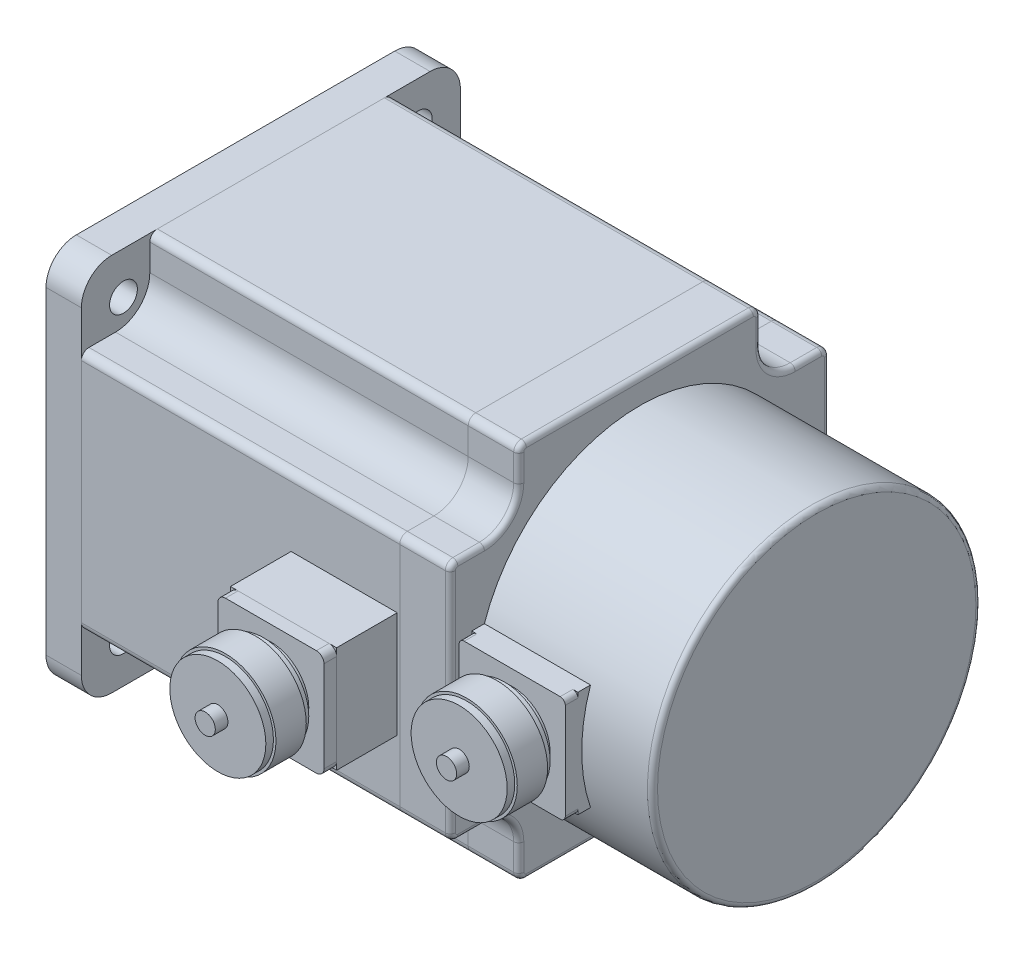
SolidWorks part; units mm, degrees
ref_plane "前视基准面" through (0, 0, 0) normal (0, 0, 1) x (1, 0, 0)
ref_plane "上视基准面" through (0, 0, 0) normal (0, 1, 0) x (1, 0, 0)
ref_plane "右视基准面" through (0, 0, 0) normal (1, 0, 0) x (0, 0, -1)
sketch "草图1" plane through (0, 0, 0) normal (1, 0, 0) x (0, 0, -1)
  line L1 (-63, -75) -> (63, -75)
  line L2 (-75, -63) -> (-75, 63)
  line L3 (-63, 75) -> (63, 75)
  line L4 (75, -63) -> (75, 63)
  line L5 (-75, -75) -> (75, 75) construction
  line L6 (-75, 75) -> (75, -75) construction
  arc A0 (63, -75) -> (75, -63) centre (63, -63) ccw
  arc A1 (-63, -75) -> (-75, -63) centre (-63, -63) cw
  arc A2 (-75, 63) -> (-63, 75) centre (-63, 63) cw
  arc A3 (63, 75) -> (75, 63) centre (63, 63) cw
  point P0 (0, 0)
  dimension "D1" = 12
extrude "凸台-拉伸1" add sketch "草图1" along normal blind 20
sketch "草图2" plane through (0, 0, 0) normal (-1, 0, 0) x (0, 0, 1)
  line L0 (-63, 75) -> (63, 75) construction
  line L1 (-63, -75) -> (63, -75)
  line L2 (-75, -63) -> (-75, 63)
  line L3 (-63, 75) -> (63, 75)
  line L4 (75, -63) -> (75, 63)
  line L5 (-75, -75) -> (75, 75) construction
  line L6 (-75, 75) -> (75, -75) construction
  arc A0 (63, 75) -> (75, 63) centre (63, 63) cw
  arc A1 (63, -75) -> (75, -63) centre (63, -63) ccw
  arc A2 (-63, -75) -> (-75, -63) centre (-63, -63) cw
  arc A3 (-75, 63) -> (-63, 75) centre (-63, 63) cw
  point P0 (0, 0)
  dimension "D1" = 12
extrude "凸台-拉伸2" add sketch "草图2" along normal blind 126 separate body
sketch "草图3" plane through (-126, 0, 0) normal (-1, 0, 0) x (0, 0, 1)
  line L0 (63, 75) -> (-63, 75) construction
  line L1 (-63, -75) -> (63, -75)
  line L2 (-75, -63) -> (-75, 63)
  line L3 (-63, 75) -> (63, 75)
  line L4 (75, -63) -> (75, 63)
  line L5 (-75, -75) -> (75, 75) construction
  line L6 (-75, 75) -> (75, -75) construction
  arc A0 (-63, -75) -> (-75, -63) centre (-63, -63) cw
  arc A1 (63, -75) -> (75, -63) centre (63, -63) ccw
  arc A2 (63, 75) -> (75, 63) centre (63, 63) cw
  arc A3 (-75, 63) -> (-63, 75) centre (-63, 63) cw
  point P0 (0, 0)
  dimension "D1" = 12
extrude "凸台-拉伸3" add sketch "草图3" along normal blind 14 separate body
sketch "草图4" plane through (0, 0, 75) normal (0, 0, 1) x (1, 0, 0)
  line L2 (-43, -21) -> (-1, -21)
  line L3 (-43, -21) -> (-43, 21)
  line L4 (-43, 21) -> (-1, 21)
  line L5 (-1, -21) -> (-1, 21)
  line L6 (-43, -21) -> (-1, 21) construction
  line L7 (-43, 21) -> (-1, -21) construction
extrude "凸台-拉伸4" add sketch "草图4" along normal blind 24 separate body
sketch "草图5" plane through (0, 0, 99) normal (0, 0, 1) x (1, 0, 0)
  line L0 (-1, 21) -> (-43, 21) construction
  line L1 (-40, -21) -> (-4, -21)
  line L2 (-43, -18) -> (-43, 18)
  line L3 (-40, 21) -> (-4, 21)
  line L4 (-1, -18) -> (-1, 18)
  line L5 (-43, -21) -> (-1, 21) construction
  line L6 (-43, 21) -> (-1, -21) construction
  arc A0 (-40, -21) -> (-43, -18) centre (-40, -18) cw
  arc A1 (-4, -21) -> (-1, -18) centre (-4, -18) ccw
  arc A2 (-4, 21) -> (-1, 18) centre (-4, 18) cw
  arc A3 (-43, 18) -> (-40, 21) centre (-40, 18) cw
  point P0 (-22, 0)
  dimension "D1" = 3
extrude "凸台-拉伸5" add sketch "草图5" along normal blind 5 separate body
sketch "草图6" plane through (0, 0, 104) normal (0, 0, 1) x (1, 0, 0)
  circle A0 centre (-22, 0) radius 15
extrude "凸台-拉伸6" add sketch "草图6" along normal blind 3 separate body
sketch "草图7" plane through (0, 0, 107) normal (0, 0, 1) x (1, 0, 0)
  circle A0 centre (-22, 0) radius 18
extrude "凸台-拉伸7" add sketch "草图7" along normal blind 3 separate body
sketch "草图8" plane through (0, 0, 110) normal (0, 0, 1) x (1, 0, 0)
  circle A0 centre (-22, 0) radius 20
extrude "凸台-拉伸8" add sketch "草图8" along normal blind 12 separate body
sketch "草图9" plane through (0, 0, 122) normal (0, 0, 1) x (1, 0, 0)
  circle A0 centre (-22, 0) radius 19
extrude "凸台-拉伸9" add sketch "草图9" along normal blind 3
sketch "草图10" plane through (0, 0, 125) normal (0, 0, 1) x (1, 0, 0)
  circle A0 centre (-22, 0) radius 4
extrude "凸台-拉伸10" add sketch "草图10" along normal blind 5
sketch "草图11" plane through (20, 0, 0) normal (1, 0, 0) x (0, 0, -1)
  line L0 (47.9169, -61.5) -> (47.9169, -72)
  line L1 (-75, -44.9169) -> (-75, -63)
  line L2 (-63, -75) -> (-44.9169, -75)
  line L3 (44.9169, -75) -> (63, -75)
  line L4 (75, -63) -> (75, -44.9169)
  line L6 (75, 63) -> (75, 44.9169)
  line L7 (-63, -75) -> (63, -75) construction
  line L8 (63, 75) -> (44.9169, 75)
  line L9 (-47.9169, -72) -> (-47.9169, -61.5)
  line L10 (-44.9169, 75) -> (-63, 75)
  line L11 (-61.5, -47.9169) -> (-72, -47.9169)
  line L12 (75, -63) -> (75, 63) construction
  line L13 (-75, 63) -> (-75, 44.9169)
  line L14 (-72, 47.9169) -> (-61.5, 47.9169)
  line L16 (-47.9169, 61.5) -> (-47.9169, 72)
  line L17 (63, 75) -> (-63, 75) construction
  line L19 (47.9169, 72) -> (47.9169, 61.5)
  line L21 (61.5, 47.9169) -> (72, 47.9169)
  line L22 (-75, 63) -> (-75, -63) construction
  line L24 (72, -47.9169) -> (61.5, -47.9169)
  arc A0 (-61.5, 47.9169) -> (-47.9169, 61.5) centre (-61.5, 61.5) ccw
  arc A1 (47.9169, 61.5) -> (61.5, 47.9169) centre (61.5, 61.5) ccw
  arc A2 (-47.9169, -61.5) -> (-61.5, -47.9169) centre (-61.5, -61.5) ccw
  arc A3 (-72, -47.9169) -> (-75, -44.9169) centre (-72, -44.9169) cw
  arc A4 (61.5, -47.9169) -> (47.9169, -61.5) centre (61.5, -61.5) ccw
  arc A5 (-75, 44.9169) -> (-72, 47.9169) centre (-72, 44.9169) cw
  arc A6 (-47.9169, 72) -> (-44.9169, 75) centre (-44.9169, 72) cw
  arc A7 (44.9169, 75) -> (47.9169, 72) centre (44.9169, 72) cw
  arc A8 (72, 47.9169) -> (75, 44.9169) centre (72, 44.9169) cw
  arc A9 (75, -44.9169) -> (72, -47.9169) centre (72, -44.9169) cw
  arc A10 (47.9169, -72) -> (44.9169, -75) centre (44.9169, -72) cw
  arc A11 (-44.9169, -75) -> (-47.9169, -72) centre (-44.9169, -72) cw
  arc A12 (-63, 75) -> (-75, 63) centre (-63, 63) ccw
  arc A13 (75, 63) -> (63, 75) centre (63, 63) ccw
  arc A14 (63, -75) -> (75, -63) centre (63, -63) ccw
  arc A15 (-75, -63) -> (-63, -75) centre (-63, -63) ccw
  point P0 (0, 0)
  point P1 (0, 0)
  point P12 (-75, -47.9169)
  point P43 (-75, 47.9169)
  point P47 (-47.9169, 75)
  point P48 (51.9891, -75)
  point P52 (47.9169, 75)
  point P56 (75, 47.9169)
  point P65 (75, -47.9169)
  point P82 (-47.9169, -75)
  dimension "D1" = 3
extrude "切除-拉伸2" cut sketch "草图11" against normal blind 146
fillet "圆角1" radius 2 24 edges at (20, 75, 0) (20, 0, -75) (20, -75, 0) (20, 0, 75) (20, 47.0382, 74.1213) (20, 47.9169, 66.75) (20, 51.8953, 51.8953) (20, 66.75, 47.9169) (20, 74.1213, 47.0382) (20, 74.1213, -47.0382) (20, 66.75, -47.9169) (20, 51.8953, -51.8953) (20, 47.9169, -66.75) (20, 47.0382, -74.1213) (20, -47.0382, -74.1213) (20, -47.9169, -66.75) (20, -51.8953, -51.8953) (20, -66.75, -47.9169) (20, -74.1213, -47.0382) (20, -74.1213, 47.0382) (20, -66.75, 47.9169) (20, -51.8953, 51.8953) (20, -47.9169, 66.75) (20, -47.0382, 74.1213)
sketch "草图12" plane through (-140, 0, 0) normal (-1, 0, 0) x (0, 0, 1)
  circle A2 centre (-58.3363, 58.3363) radius 5.5
  circle A3 centre (58.3363, 58.3363) radius 5.5
  circle A4 centre (58.3363, -58.3363) radius 5.5
  circle A5 centre (-58.3363, -58.3363) radius 5.5
extrude "切除-拉伸3" cut sketch "草图12" against normal blind 14
sketch "草图13" plane through (-140, 0, 0) normal (-1, 0, 0) x (0, 0, 1)
  circle A0 centre (0, 0) radius 65
  circle A1 centre (0, 0) radius 57.5
extrude "凸台-拉伸11" add sketch "草图13" along normal blind 5 separate body
sketch "草图14" plane through (-140, 0, 0) normal (-1, 0, 0) x (0, 0, 1)
  circle A0 centre (0, 0) radius 35
extrude "凸台-拉伸12" add sketch "草图14" along normal blind 5
sketch "草图15" plane through (-145, 0, 0) normal (-1, 0, 0) x (0, 0, 1)
  circle A0 centre (0, 0) radius 17.5
extrude "凸台-拉伸13" add sketch "草图15" along normal blind 0.5 separate body
fillet "圆角2" radius 0.5 1 edges at (-145.5, 0, 17.5)
sketch "草图16" plane through (-145.5, 0, 0) normal (-1, 0, 0) x (0, 0, 1)
  circle A0 centre (0, 0) radius 14
extrude "凸台-拉伸14" add sketch "草图16" along normal blind 52.5
chamfer "倒角1" distance 0.5 angle 45 1 edges at (-198, 0, 14)
ref_plane "基准面1" through (0, -14, 0) normal (0, 1, 0) x (1, 0, 0)
sketch "草图19" plane through (20, 0, 0) normal (1, 0, 0) x (0, 0, -1)
  circle A0 centre (0, 0) radius 65
extrude "凸台-拉伸16" add sketch "草图19" along normal blind 70 separate body
fillet "圆角3" radius 2 1 edges at (90, 0, -65)
ref_plane "基准面2" through (0, 0, 65) normal (0, 0, 1) x (1, 0, 0)
sketch "草图20" plane through (0, 0, 65) normal (0, 0, 1) x (1, 0, 0)
  line L1 (20, 65) -> (20, -65) construction
  line L3 (62, -21) -> (20, -21)
  line L4 (62, -21) -> (62, 21)
  line L5 (62, 21) -> (20, 21)
  line L6 (20, -21) -> (20, 21)
  line L7 (62, -21) -> (20, 21) construction
  line L8 (62, 21) -> (20, -21) construction
extrude "切除-拉伸5" cut sketch "草图20" against normal blind 10
sketch "草图21" plane through (0, 0, 55) normal (0, 0, 1) x (1, 0, 0)
  line L0 (62, 21) -> (20, 21) construction
  line L1 (20, -21) -> (62, -21)
  line L2 (20, -21) -> (20, 21)
  line L3 (20, 21) -> (62, 21)
  line L4 (62, -21) -> (62, 21)
  line L5 (20, -21) -> (62, 21) construction
  line L6 (20, 21) -> (62, -21) construction
  line L7 (20, 21) -> (62, 21) construction
  point P0 (41, 0)
extrude "凸台-拉伸17" add sketch "草图21" along normal blind 11.5
sketch "草图22" plane through (0, 0, 66.5) normal (0, 0, 1) x (1, 0, 0)
  line L0 (62, -21) -> (62, 21) construction
  line L1 (22, -21) -> (60, -21)
  line L2 (20, -19) -> (20, 19)
  line L3 (22, 21) -> (60, 21)
  line L4 (62, -19) -> (62, 19)
  line L5 (20, -21) -> (62, 21) construction
  line L6 (20, 21) -> (62, -21) construction
  line L7 (20, 21) -> (62, 21) construction
  arc A0 (22, -21) -> (20, -19) centre (22, -19) cw
  arc A1 (60, -21) -> (62, -19) centre (60, -19) ccw
  arc A2 (60, 21) -> (62, 19) centre (60, 19) cw
  arc A3 (20, 19) -> (22, 21) centre (22, 19) cw
  point P0 (41, 0)
  dimension "D1" = 2
extrude "凸台-拉伸18" add sketch "草图22" along normal blind 5 separate body
sketch "草图23" plane through (0, 0, 71.5) normal (0, 0, 1) x (1, 0, 0)
  circle A0 centre (41, 0) radius 15
extrude "凸台-拉伸19" add sketch "草图23" along normal blind 3
sketch "草图24" plane through (0, 0, 74.5) normal (0, 0, 1) x (1, 0, 0)
  circle A0 centre (41, 0) radius 18
extrude "凸台-拉伸20" add sketch "草图24" along normal blind 3
sketch "草图25" plane through (0, 0, 77.5) normal (0, 0, 1) x (1, 0, 0)
  circle A0 centre (41, 0) radius 20
extrude "凸台-拉伸21" add sketch "草图25" along normal blind 12
sketch "草图26" plane through (0, 0, 89.5) normal (0, 0, 1) x (1, 0, 0)
  circle A0 centre (41, 0) radius 19
extrude "凸台-拉伸22" add sketch "草图26" along normal blind 3
sketch "草图27" plane through (0, 0, 92.5) normal (0, 0, 1) x (1, 0, 0)
  circle A0 centre (41, 0) radius 4
extrude "凸台-拉伸23" add sketch "草图27" along normal blind 5
sketch "草图36" plane through (0, -14, 0) normal (0, 1, 0) x (1, 0, 0)
  line L3 (-190, -4) -> (-153, -4)
  line L5 (-153, 4) -> (-190, 4)
  arc A0 (-190, 4) -> (-190, -4) centre (-190, 0) ccw
  arc A1 (-153, -4) -> (-153, 4) centre (-153, 0) ccw
extrude "切除-拉伸9" cut sketch "草图36" along normal blind 5
sketch "草图37" plane through (0, -9, 0) normal (0, -1, 0) x (1, 0, 0)
  line L0 (-190, 4) -> (-153, 4)
  line L2 (-153, -4) -> (-190, -4)
  arc A0 (-190, 4) -> (-190, -4) centre (-190, 0) ccw
  arc A1 (-153, -4) -> (-153, 4) centre (-153, 0) ccw
extrude "凸台-拉伸26" add sketch "草图37" along normal blind 8 separate body
